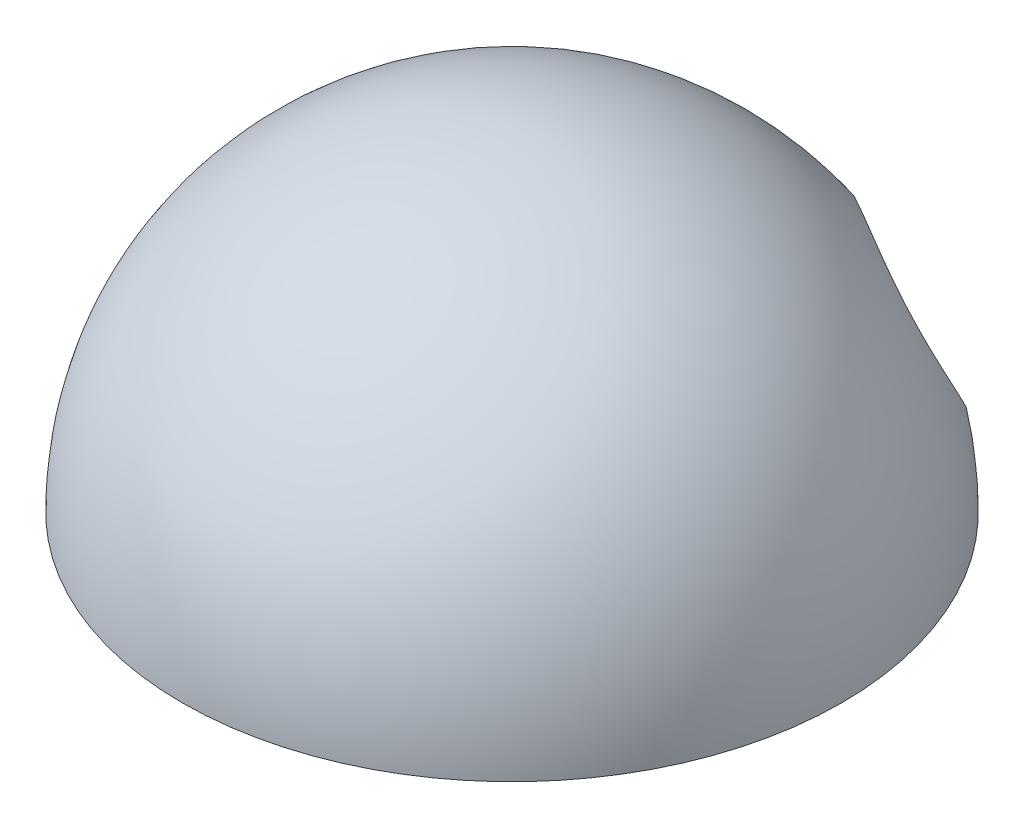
SolidWorks part; units mm, degrees
ref_plane "Front Plane" through (0, 0, 0) normal (0, 0, 1) x (1, 0, 0)
ref_plane "Top Plane" through (0, 0, 0) normal (0, 1, 0) x (1, 0, 0)
ref_plane "Right Plane" through (0, 0, 0) normal (1, 0, 0) x (0, 0, -1)
sketch "Sketch1" plane through (0, 0, 0) normal (0, 1, 0) x (1, 0, 0)
  line L0 (-32.5, 0) -> (32.5, 0)
  arc A0 (32.5, 0) -> (-32.5, 0) centre (0, 0) ccw
  dimension "D1" = 65
revolve "Revolve6" add sketch "Sketch1" angle 180 about L0
sketch "Sketch3" plane through (0, 0, 0) normal (0, 0, 1) x (1, 0, 0)
  line L0 (-32.5, 0) -> (32.5, 0) construction
  circle A0 centre (-13, 11.5) radius 8.5
  circle A1 centre (13, 11.5) radius 8.5
  dimension "D1" = 17
  dimension "D2" = 17
  dimension "D3" = 26
  dimension "D4" = 13
  dimension "D5" = 11.5
extrude "Cut-Extrude1" cut sketch "Sketch3" against normal blind 50
sketch "Sketch5" plane through (0, 0, 0) normal (0, 1, 0) x (1, 0, 0)
  line L0 (-31, 0) -> (31, 0)
  arc A0 (-31, 0) -> (31, 0) centre (0, 0) ccw
  dimension "D1" = 62
revolve "Cut-Revolve1" cut sketch "Sketch5" angle 90 about L0
